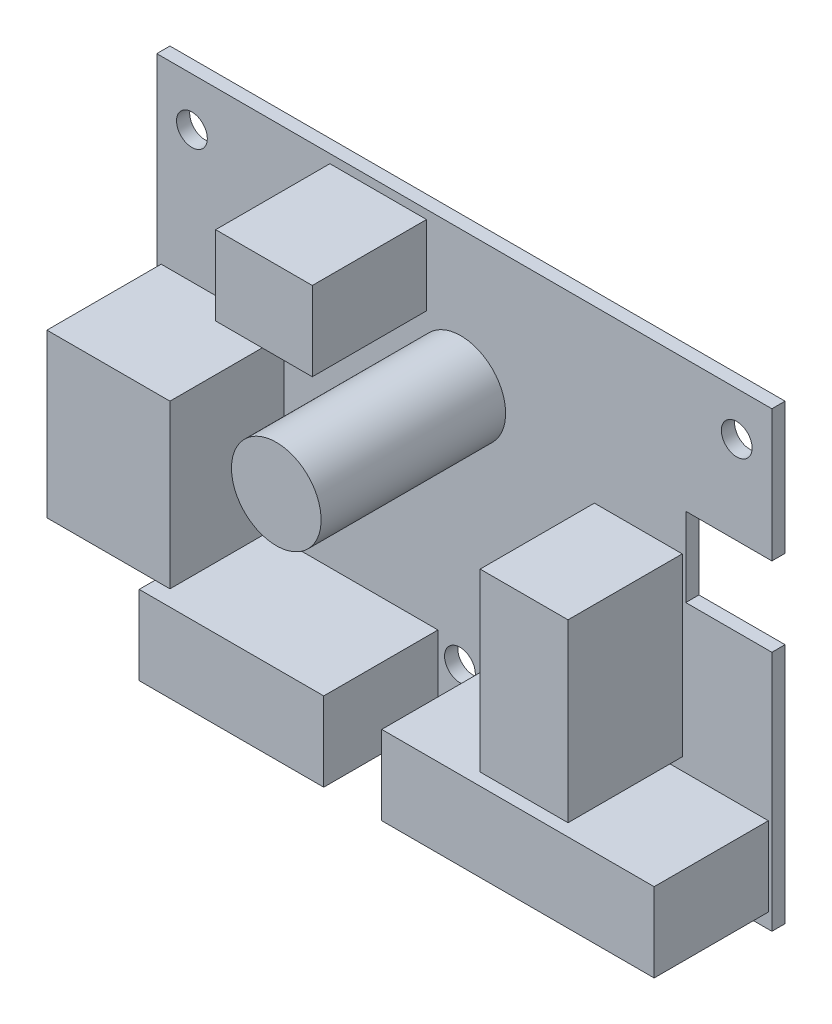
SolidWorks part; units mm, degrees
ref_plane "Přední rovina" through (0, 0, 0) normal (0, 0, 1) x (1, 0, 0)
ref_plane "Horní rovina" through (0, 0, 0) normal (0, 1, 0) x (1, 0, 0)
ref_plane "Pravá rovina" through (0, 0, 0) normal (1, 0, 0) x (0, 0, -1)
sketch "Skica1" plane through (0, 0, 0) normal (0, 0, 1) x (1, 0, 0)
  line L0 (42.2232, 20.248) -> (42.2232, 5.248)
  line L1 (-27.7768, 20.248) -> (42.2232, 20.248)
  line L2 (-27.7768, 20.248) -> (-27.7768, -31.252)
  line L3 (-27.7768, -31.252) -> (42.2232, -31.252)
  line L4 (42.2232, 5.248) -> (32.4232, 5.248)
  line L5 (32.4232, 5.248) -> (32.4232, -3.752)
  line L6 (32.4232, -3.752) -> (42.2232, -3.752)
  line L7 (42.2232, -3.752) -> (42.2232, -31.252)
  circle A0 centre (-23.7768, 14.748) radius 1.75
  circle A1 centre (38.2232, 15.248) radius 1.75
  circle A2 centre (6.7232, -22.752) radius 1.75
  circle A3 centre (-23.7768, -26.752) radius 1.75
  dimension "D5" = 3.5
  dimension "D1" = 51.5
  dimension "D2" = 70
  dimension "D3" = 9
  dimension "D4" = 27.5
  dimension "D6" = 4
  dimension "D7" = 5
  dimension "D8" = 5.5
  dimension "D9" = 4
  dimension "D10" = 4
  dimension "D11" = 4.5
  dimension "D12" = 8.5
  dimension "D13" = 34.5
  dimension "D15" = 9.8
extrude "Přidat vysunutím1" add sketch "Skica1" along normal blind 1.5
sketch "Skica2" plane through (0, 0, 1.5) normal (0, 0, 1) x (1, 0, 0)
  line L0 (-27.7768, 20.248) -> (-27.7768, -31.252) construction
  line L1 (-8.0768, 19.248) -> (2.9232, 19.248)
  line L2 (-8.0768, 19.248) -> (-8.0768, 10.248)
  line L3 (-8.0768, 10.248) -> (2.9232, 10.248)
  line L4 (2.9232, 19.248) -> (2.9232, 10.248)
  line L5 (-27.2768, -0.252) -> (-13.2768, -0.252)
  line L6 (-27.2768, -0.252) -> (-27.2768, -18.752)
  line L7 (-27.2768, -18.752) -> (-13.2768, -18.752)
  line L8 (-13.2768, -0.252) -> (-13.2768, -18.752)
  line L9 (-16.7768, -20.552) -> (4.2232, -20.552)
  line L10 (-16.7768, -20.552) -> (-16.7768, -29.552)
  line L11 (-16.7768, -29.552) -> (4.2232, -29.552)
  line L12 (4.2232, -20.552) -> (4.2232, -29.552)
  line L13 (10.8232, -20.552) -> (41.8232, -20.552)
  line L14 (10.8232, -20.552) -> (10.8232, -29.552)
  line L15 (10.8232, -29.552) -> (41.8232, -29.552)
  line L16 (41.8232, -20.552) -> (41.8232, -29.552)
  line L17 (22.0232, 0.848) -> (32.0232, 0.848)
  line L18 (22.0232, 0.848) -> (22.0232, -19.152)
  line L19 (22.0232, -19.152) -> (32.0232, -19.152)
  line L20 (32.0232, 0.848) -> (32.0232, -19.152)
  line L21 (42.2232, -31.252) -> (42.2232, -3.752) construction
  line L22 (-27.7768, -31.252) -> (42.2232, -31.252) construction
  line L23 (42.2232, 20.248) -> (-27.7768, 20.248) construction
  point P20 (-27.7768, -5.502)
  dimension "D1" = 11
  dimension "D2" = 14
  dimension "D3" = 21
  dimension "D4" = 31
  dimension "D5" = 10
  dimension "D6" = 9
  dimension "D7" = 18.5
  dimension "D8" = 9
  dimension "D9" = 9
  dimension "D10" = 20
  dimension "D11" = 0.5
  dimension "D12" = 11
  dimension "D13" = 6.6
  dimension "D14" = 19.7
  dimension "D15" = 10.2
  dimension "D16" = 1.7
  dimension "D17" = 1.7
  dimension "D18" = 12.5
  dimension "D19" = 19.4
  dimension "D20" = 1
extrude "Přidat vysunutím2" add sketch "Skica2" along normal blind 13
sketch "Skica4" plane through (0, 0, 1.5) normal (0, 0, 1) x (1, 0, 0)
  line L0 (42.2232, 20.248) -> (-27.7768, 20.248) construction
  line L1 (-27.7768, 20.248) -> (-27.7768, -31.252) construction
  circle A0 centre (6.8232, 4.648) radius 5.1
  dimension "D1" = 10.2
  dimension "D2" = 15.6
  dimension "D3" = 34.6
extrude "Přidat vysunutím3" add sketch "Skica4" along normal blind 21
sketch "Skica5" plane through (0, 0, 0) normal (0, 0, -1) x (-1, 0, 0)
  line L0 (27.7768, 20.248) -> (27.7768, -31.252) construction
  line L1 (-28.9232, 15.248) -> (-20.4232, 15.248)
  line L2 (-28.9232, 15.248) -> (-28.9232, 5.248)
  line L3 (-28.9232, 5.248) -> (-20.4232, 5.248)
  line L4 (-20.4232, 15.248) -> (-20.4232, 5.248)
  line L5 (5.7768, 11.248) -> (14.2768, 11.248)
  line L6 (5.7768, 11.248) -> (5.7768, 4.748)
  line L7 (5.7768, 4.748) -> (14.2768, 4.748)
  line L8 (14.2768, 11.248) -> (14.2768, 4.748)
  line L9 (-42.2232, 20.248) -> (27.7768, 20.248) construction
  line L10 (-42.2232, 5.248) -> (-42.2232, 20.248) construction
  dimension "D1" = 10
  dimension "D2" = 8.5
  dimension "D3" = 8.5
  dimension "D4" = 6.5
  dimension "D5" = 13.5
  dimension "D6" = 9
  dimension "D7" = 5
  dimension "D8" = 13.3
extrude "Přidat vysunutím4" add sketch "Skica5" along normal blind 4.2
sketch "Skica6" plane through (0, 0, 0) normal (0, 0, -1) x (-1, 0, 0)
  text T0 "www.prochazka.zde.cz" font "Arial" height in points 8
extrude "Přidat vysunutím5" add sketch "Skica6" along normal blind 0.1
